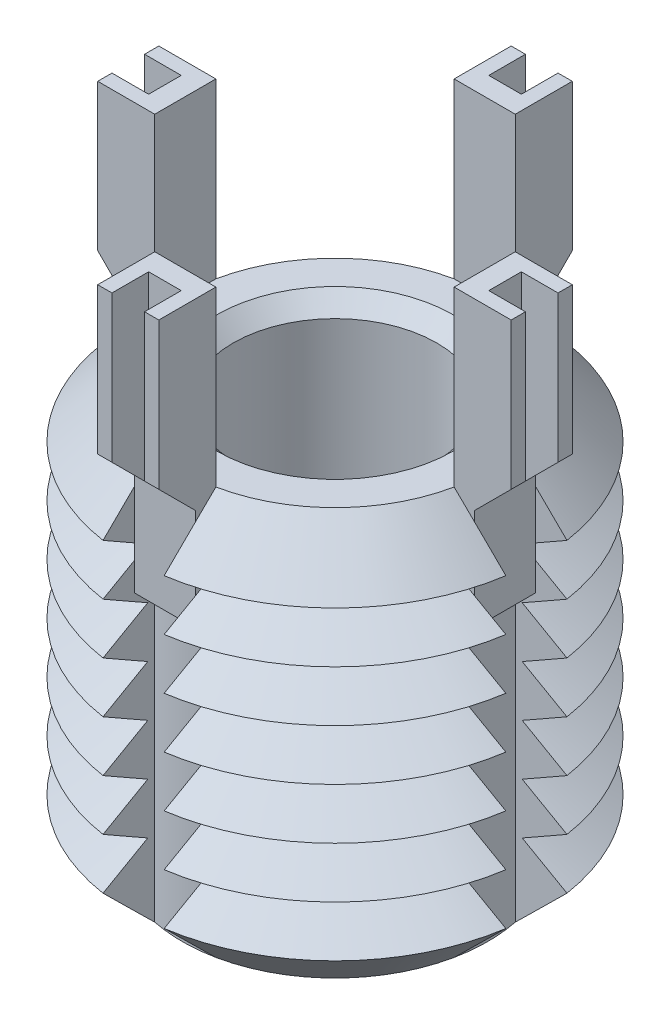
SolidWorks part; units mm, degrees
ref_plane "Front Plane" through (0, 0, 0) normal (0, 0, 1) x (1, 0, 0)
ref_plane "Top Plane" through (0, 0, 0) normal (0, 1, 0) x (1, 0, 0)
ref_plane "Right Plane" through (0, 0, 0) normal (1, 0, 0) x (0, 0, -1)
sketch "Sketch1" plane through (0, 0, 0) normal (0, 1, 0) x (1, 0, 0)
  circle A0 centre (0, 0) radius 5
  dimension "D1" = 10
extrude "Boss-Extrude1" add sketch "Sketch1" against normal blind 10
chamfer "Chamfer1" distance 1.25 angle 45 2 edges at (0, -10, 5) (0, 0, 5)
sketch "Sketch2" plane through (0, 0, 0) normal (1, 0, 0) x (0, 0, -1)
  line L0 (0, 0.8859) -> (0, -9.2617) construction
sketch "Sketch3" plane through (0, 0, 0) normal (1, 0, 0) x (0, 0, -1)
  line L0 (-5, -1.25) -> (-3.9175, -1.875)
  line L1 (-3.9175, -1.875) -> (-5, -2.5)
  line L2 (-5, -1.25) -> (-5, -8.75) construction
  line L3 (-5, -2.5) -> (-5, -1.25)
  dimension "D1" = 1.25
revolve "Cut-Revolve1" cut sketch "Sketch3" angle 360 about L0
pattern_linear "LPattern1" count 6 spacing 1.25 along (0, -1, 0) of "Cut-Revolve1"
sketch "Sketch4" plane through (0, 0, 0) normal (0, 1, 0) x (1, 0, 0)
  line L0 (-3.6742, 0.75) -> (-4.9434, 0.75)
  line L2 (-4.9434, -0.75) -> (-3.6742, -0.75)
  arc A0 (-3.6742, 0.75) -> (-3.6742, -0.75) centre (0, 0) ccw
  arc A1 (-4.9434, 0.75) -> (-4.9434, -0.75) centre (0, 0) ccw
  circle A2 centre (0, 0) radius 5 construction
  circle A3 centre (0, 0) radius 3.75 construction
  point P1 (-3.75, 0)
  point P3 (-5, 0)
  point P13 (0, 0)
  dimension "D1" = 1.5
extrude "Cut-Extrude1" cut sketch "Sketch4" against normal up to surface (10 mm away)
pattern_circular "CirPattern1" count 4 over 360 about axis through (0, 0, 0) along (0, 1, 0) of "Cut-Extrude1"
sketch "Sketch5" plane through (0, 0, 0) normal (1, 0, 0) x (0, 0, -1)
  line L0 (-3.6742, 4.25) -> (-3.6742, -2.75)
  line L1 (-3.6742, -2.75) -> (-4.1742, -2.75)
  line L2 (-4.1742, -2.75) -> (-4.1742, -0.25)
  line L3 (-4.1742, -0.25) -> (-5.0742, 0.65)
  line L4 (-5.0742, 0.65) -> (-5.0742, 4.25)
  line L5 (-5.0742, 4.25) -> (-3.6742, 4.25)
  line L6 (-4.9434, -3.75) -> (-0.75, -3.75) construction
  point P9 (-0.75, 0)
  point P10 (-4.1742, -0.25)
  dimension "D1" = 1
  dimension "D2" = 7
  dimension "D3" = 4.5
  dimension "D4" = 1.4
  dimension "D5" = 0.5
  dimension "D6" = 45
extrude "Boss-Extrude3" add sketch "Sketch5" along normal mid plane 1.5
pattern_circular "CirPattern2" count 4 over 360 about axis through (0, 0, 0) along (0, 1, 0) of "Boss-Extrude3"
sketch "Sketch6" plane through (0, 4.25, 0) normal (0, 1, 0) x (1, 0, 0)
  line L0 (-5.0742, -0.75) -> (-5.0742, 0.75) construction
  line L1 (-5.0742, -0.4) -> (-4.1742, -0.4)
  line L2 (-5.0742, -0.4) -> (-5.0742, 0.4)
  line L3 (-5.0742, 0.4) -> (-4.1742, 0.4)
  line L4 (-4.1742, -0.4) -> (-4.1742, 0.4)
  line L5 (-5.0742, -0.4) -> (-4.1742, 0.4) construction
  line L6 (-5.0742, 0.4) -> (-4.1742, -0.4) construction
  line L7 (5.0742, 0.75) -> (5.0742, -0.75) construction
  line L8 (-0.4, 4.1742) -> (0.4, 4.1742)
  line L9 (-0.4, 4.1742) -> (-0.4, 5.0742)
  line L10 (-0.4, 5.0742) -> (0.4, 5.0742)
  line L11 (0.4, 4.1742) -> (0.4, 5.0742)
  line L12 (-0.4, 4.1742) -> (0.4, 5.0742) construction
  line L13 (-0.4, 5.0742) -> (0.4, 4.1742) construction
  line L14 (4.1742, -0.4) -> (5.0742, -0.4)
  line L15 (4.1742, -0.4) -> (4.1742, 0.4)
  line L16 (4.1742, 0.4) -> (5.0742, 0.4)
  line L17 (5.0742, -0.4) -> (5.0742, 0.4)
  line L18 (4.1742, -0.4) -> (5.0742, 0.4) construction
  line L19 (4.1742, 0.4) -> (5.0742, -0.4) construction
  line L20 (-0.4, -5.0742) -> (0.4, -5.0742)
  line L21 (-0.4, -5.0742) -> (-0.4, -4.1742)
  line L22 (-0.4, -4.1742) -> (0.4, -4.1742)
  line L23 (0.4, -5.0742) -> (0.4, -4.1742)
  line L24 (-0.4, -5.0742) -> (0.4, -4.1742) construction
  line L25 (-0.4, -4.1742) -> (0.4, -5.0742) construction
  line L26 (-0.75, 5.0742) -> (0.75, 5.0742) construction
  line L27 (0.75, -5.0742) -> (-0.75, -5.0742) construction
  point P0 (-4.6242, 0)
  point P7 (-5.0742, 0)
  point P8 (-5.0742, 0)
  point P9 (0, 4.6242)
  point P14 (4.6242, 0)
  point P19 (0, -4.6242)
  point P24 (0, 5.0742)
  point P25 (5.0742, 0)
  point P26 (5.0742, 0)
  point P27 (0, 5.0742)
  point P30 (0, -5.0742)
  point P33 (0, -5.0742)
  dimension "D1" = 0.8
  dimension "D2" = 0.9
extrude "Cut-Extrude3" cut sketch "Sketch6" against normal through all both and the other way through all
sketch "Sketch7" plane through (0, 0, 0) normal (0, 1, 0) x (1, 0, 0)
  circle A0 centre (0, 0) radius 2.5
  dimension "D1" = 5
extrude "Cut-Extrude4" cut sketch "Sketch7" against normal up to surface (10 mm away)
chamfer "Chamfer2" distance 0.4 angle 45 2 edges at (0, 0, 2.5) (0, -10, 2.5)
